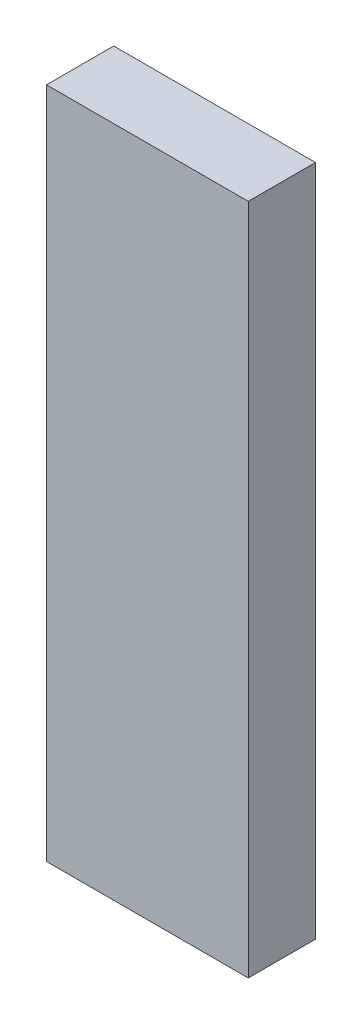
SolidWorks part; units mm, degrees
other "Markup1"
sketch "Sketch5" plane through (-15, 450, -31) normal (-0.4689, 0.8736, -0.1304) x (0.8808, 0.4735, 0.005)
ref_plane "Front Plane" through (0, 0, 0) normal (0, 0, 1) x (1, 0, 0)
ref_plane "Top Plane" through (0, 0, 0) normal (0, 1, 0) x (1, 0, 0)
ref_plane "Right Plane" through (0, 0, 0) normal (1, 0, 0) x (0, 0, -1)
sketch "Sketch6" plane through (0, 0, 0) normal (0, 0, 1) x (1, 0, 0)
  line L0 (15, -100) -> (30, -100)
  line L1 (-15, -100) -> (-30, -100)
  line L2 (-30, -100) -> (-30, 100)
  line L3 (-30, 100) -> (30, 100)
  line L4 (30, 100) -> (30, -100)
  line L5 (-15, -100) -> (15, -100)
  dimension "D1" = 60
  dimension "D2" = 200
  dimension "D3" = 30
  dimension "D4" = 100
extrude "Boss-Extrude1" add sketch "Sketch6" along normal blind 20
sketch "Sketch7" plane through (0, -100, 0) normal (0, -1, 0) x (1, 0, 0)
  line L0 (-7.5, 20) -> (-7.5, 0)
  line L1 (-30, 20) -> (30, 20) construction
  line L2 (-30, 0) -> (30, 0) construction
  line L3 (-7.5, 0) -> (7.5, 0)
  line L4 (7.5, 0) -> (7.5, 20)
  line L5 (7.5, 20) -> (-7.5, 20)
  dimension "D1" = 15
  dimension "D2" = 7.5
extrude "Boss-Extrude2" [suppressed] add sketch "Sketch7" along normal blind 300
sketch "Sketch8" [suppressed] plane through (7.5, 0, 0) normal (1, 0, 0) x (0, 0, -1)
  line L0 (-20, -300) -> (0, -300)
  line L1 (-20, -400) -> (-20, -100) construction
  line L2 (0, -400) -> (0, -100) construction
  line L3 (0, -300) -> (0, -400)
  line L4 (0, -400) -> (-20, -400)
  line L5 (-20, -400) -> (-20, -300)
  dimension "D1" = 100
extrude "Cut-Extrude1" [suppressed] cut sketch "Sketch8" against normal blind 20
sketch "Sketch9" plane through (0, -100, 0) normal (0, -1, 0) x (1, 0, 0)
  line L0 (-6.05, 13.55) -> (-6.05, 6.45)
  line L1 (-6.05, 6.45) -> (6.05, 6.45)
  line L2 (6.05, 6.45) -> (6.05, 13.55)
  line L3 (6.05, 13.55) -> (-6.05, 13.55)
  dimension "D1" = 12.1
  dimension "D2" = 7.1
  dimension "D3" = 6.45
  dimension "D4" = 6.05
extrude "Cut-Extrude2" cut sketch "Sketch9" against normal blind 33
